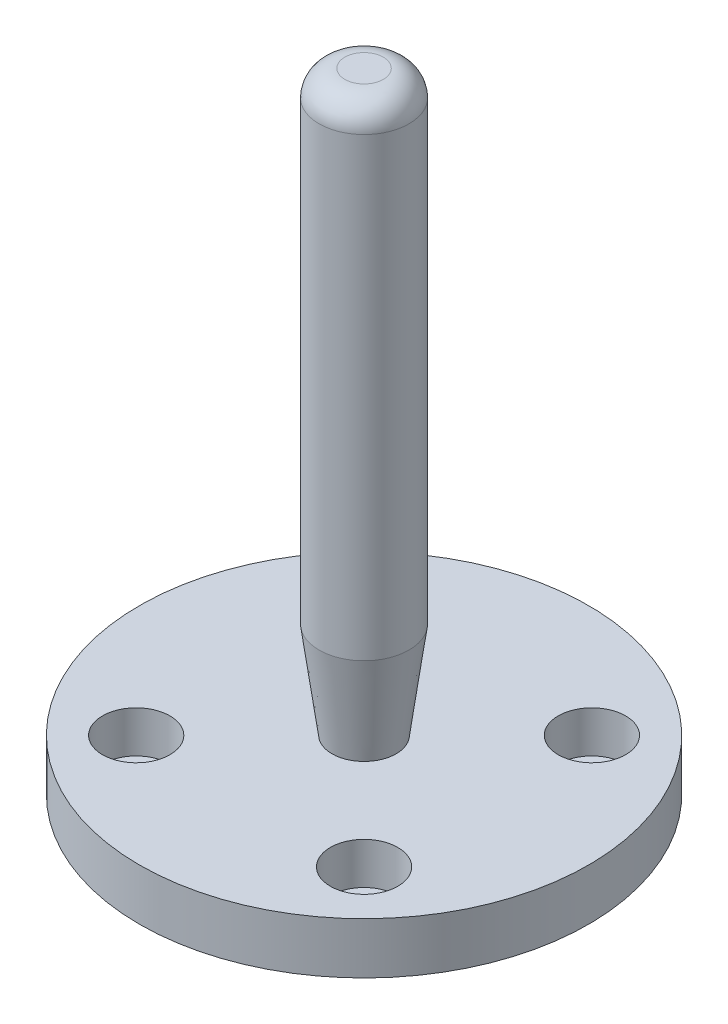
SolidWorks part; units mm, degrees
ref_plane "Front Plane" through (0, 0, 0) normal (0, 0, 1) x (1, 0, 0)
ref_plane "Top Plane" through (0, 0, 0) normal (0, 1, 0) x (1, 0, 0)
ref_plane "Right Plane" through (0, 0, 0) normal (1, 0, 0) x (0, 0, -1)
sketch "Sketch1" plane through (0, 0, 0) normal (0, 1, 0) x (1, 0, 0)
  circle A0 centre (0, 0) radius 35
  dimension "D1" = 70
extrude "Boss-Extrude1" add sketch "Sketch1" along normal blind 8
sketch "Sketch2" plane through (0, 8, 0) normal (0, 1, 0) x (1, 0, 0)
  circle A0 centre (-17.75, 17.75) radius 5.25
  circle A1 centre (17.75, 17.75) radius 5.25
  circle A2 centre (17.75, -17.75) radius 5.25
  circle A3 centre (-17.75, -17.75) radius 5.25
extrude "Cut-Extrude1" cut sketch "Sketch2" against normal blind 6.5
sketch "Sketch3" plane through (0, 1.5, 0) normal (0, 1, 0) x (1, 0, 0)
  circle A0 centre (17.75, 17.75) radius 3.25
  circle A1 centre (-17.75, 17.75) radius 3.25
  circle A2 centre (-17.75, -17.75) radius 3.25
  circle A3 centre (17.75, -17.75) radius 3.25
  dimension "D1" = 6.5
extrude "Cut-Extrude2" cut sketch "Sketch3" against normal blind 2
sketch "Sketch4" plane through (0, 0, 0) normal (0, 0, 1) x (1, 0, 0)
  line L0 (0, 8) -> (0, 98)
  line L1 (0, 98) -> (7, 98)
  line L2 (7, 98) -> (7, 23)
  line L3 (7, 23) -> (5, 8)
  line L4 (35, 8) -> (-35, 8) construction
  line L5 (5, 8) -> (0, 8)
  dimension "D1" = 90
  dimension "D2" = 15
  dimension "D3" = 7
  dimension "D4" = 5
revolve "Revolve1" add sketch "Sketch4" angle 360 about L0
fillet "Fillet2" radius 4 1 edges at (0, 98, -7)
equation "\"D5@Sketch2\"=\"D4@Sketch2\"/2"
equation "\"D9@Sketch2\"=\"D8@Sketch2\"/2"
equation "\"D3@Sketch2\"=\"D2@Sketch2\"/2"
equation "\"D7@Sketch2\"=\"D6@Sketch2\"/2"
